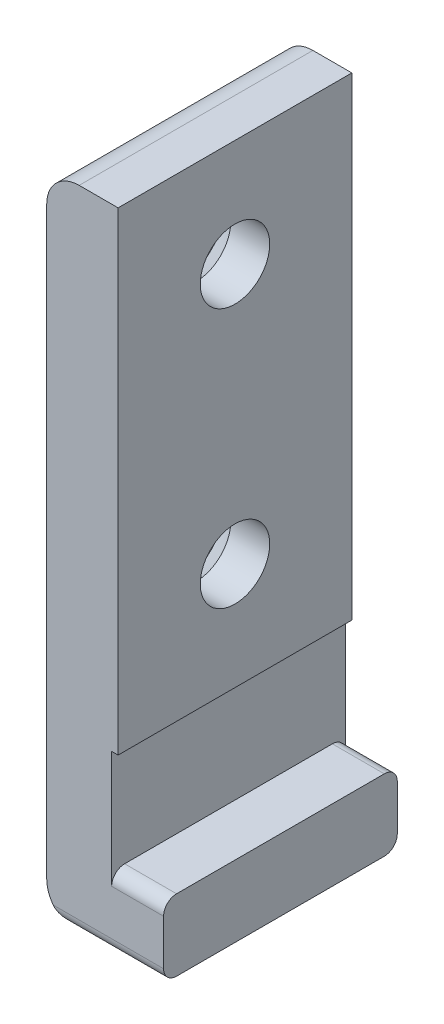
SolidWorks part; units mm, degrees
ref_plane "Спереди" through (0, 0, 0) normal (0, 0, 1) x (1, 0, 0)
ref_plane "Сверху" through (0, 0, 0) normal (0, 1, 0) x (1, 0, 0)
ref_plane "Справа" through (0, 0, 0) normal (1, 0, 0) x (0, 0, -1)
sketch "Эскиз1" plane through (0, 0, 0) normal (0, 0, 1) x (1, 0, 0)
  line L0 (0, 0) -> (0, 44.5)
  line L1 (0, 0) -> (4, 0)
  line L2 (4, 0) -> (4, -5.5)
  line L3 (4, -5.5) -> (-5, -5.5)
  line L4 (-5, -5.5) -> (-5, 44.5)
  line L5 (-5, 44.5) -> (0, 44.5)
  dimension "D1" = 5.5
  dimension "D2" = 4
  dimension "D3" = 5
  dimension "D4" = 50
extrude "Бобышка-Вытянуть1" add sketch "Эскиз1" along normal mid plane 18
fillet "Скругление1" radius 2.5 2 edges at (-5, -5.5, 0) (-5, 44.5, 0)
sketch "Эскиз2" plane through (0, 0, 9) normal (0, 0, 1) x (1, 0, 0)
  line L0 (4, 0) -> (0, 0) construction
  line L1 (0, 44.5) -> (0.5, 44.5)
  line L2 (0, 44.5) -> (0, 8)
  line L3 (0, 8) -> (0.5, 8)
  line L4 (0.5, 44.5) -> (0.5, 8)
  dimension "D1" = 0.5
  dimension "D2" = 8
extrude "Бобышка-Вытянуть2" add sketch "Эскиз2" against normal up to surface (18 mm away)
sketch "Эскиз3" plane through (0.5, 0, 0) normal (1, 0, 0) x (0, 0, -1)
  line L0 (0, 8) -> (0, 44.5) construction
  line L1 (9, 8) -> (-9, 8) construction
  line L2 (9, 44.5) -> (-9, 44.5) construction
  line L3 (0, 26.25) -> (11.9485, 26.25) construction
  circle A0 centre (0, 36.25) radius 2.675
  circle A1 centre (0, 16.25) radius 2.675
  dimension "D1" = 5.35
  dimension "D2" = 20
extrude "Вырез-Вытянуть1" cut sketch "Эскиз3" against normal through all
chamfer "Фаска1" distance 2.5 angle 45 2 edges at (-5, 13.575, 0) (-5, 38.925, 0)
fillet "Скругление2" radius 1 4 edges at (2, 0, -9) (0.75, -5.5, -9) (0.75, -5.5, 9) (2, 0, 9)
